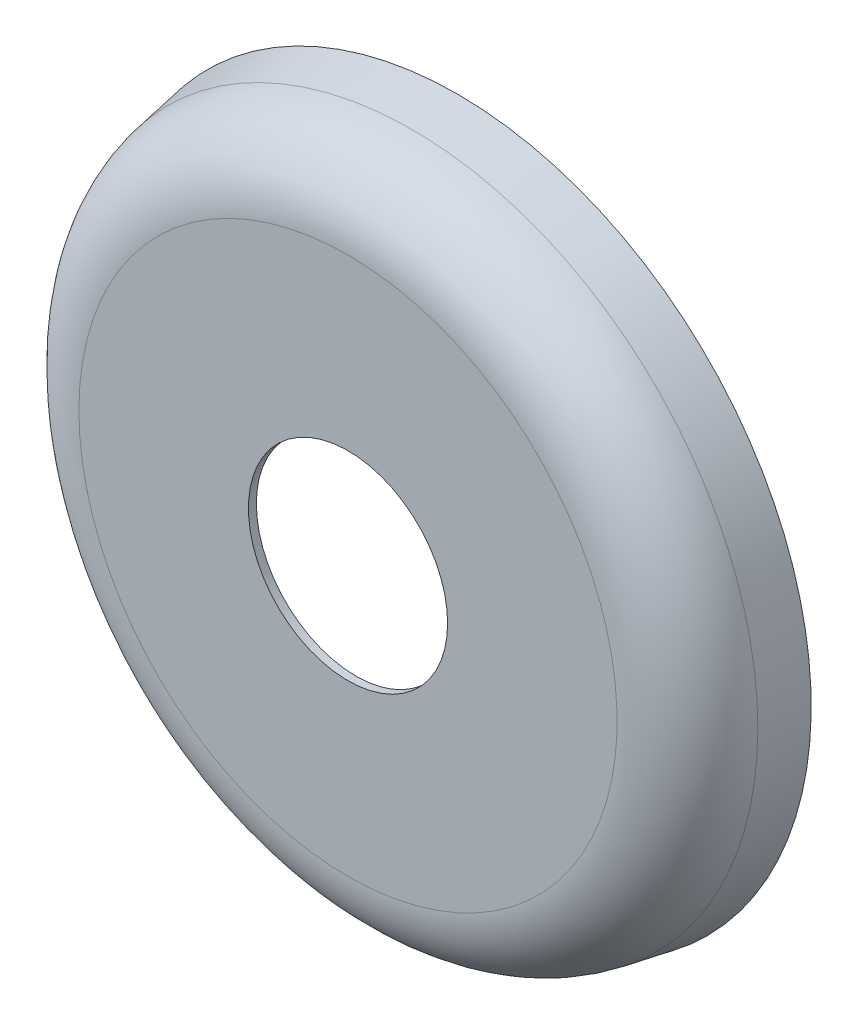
SolidWorks part; units mm, degrees
ref_plane "Plano frontal" through (0, 0, 0) normal (0, 0, 1) x (1, 0, 0)
ref_plane "Plano superior" through (0, 0, 0) normal (0, 1, 0) x (1, 0, 0)
ref_plane "Plano direito" through (0, 0, 0) normal (1, 0, 0) x (0, 0, -1)
imported_body "Importado1"
sketch "Esboço1" [suppressed] plane through (0, 0, 0) normal (0, 0, 1) x (1, 0, 0)
  circle A0 centre (0, 0) radius 41.35
  circle A1 centre (0, 0) radius 4.75
  dimension "D1" = 82.7
  dimension "D2" = 9.5
sheet metal parameters "Chapa metálica1" [suppressed] thickness 0.8 parameters "D1"=0.1
base flange "Flange-base1" [suppressed] sketch "Esboço1" thickness 0.8 reverse thickness direction no parameters "D1"=0.1
delete or keep bodies "Corpo-Excluir1" [suppressed] type delete bodies bodies 101
sketch "Esboço2" plane through (0, 0, 13.6) normal (0, 0, 1) x (1, 0, 0)
  circle A0 centre (0, 0) radius 10
  dimension "D1" = 20
extrude "Corte-extrusão1" cut sketch "Esboço2" against normal through all
flat pattern "Padrão-Plano1"
sketch "Curva-Linhas1" [suppressed] plane through (0, 0, 0) normal (0, 1, 0) x (1, 0, 0)
sketch3d "Caixa delimitadora1" [suppressed]
  line L0 (41.2999, 41.4, 0) -> (41.3999, -41.3, 0) construction
  line L1 (-41.3999, 41.3, 0) -> (-41.2999, -41.4, 0) construction
  line L2 (41.2999, 41.4, 0) -> (-41.3999, 41.3, 0) construction
  line L3 (41.3999, -41.3, 0) -> (-41.2999, -41.4, 0) construction
